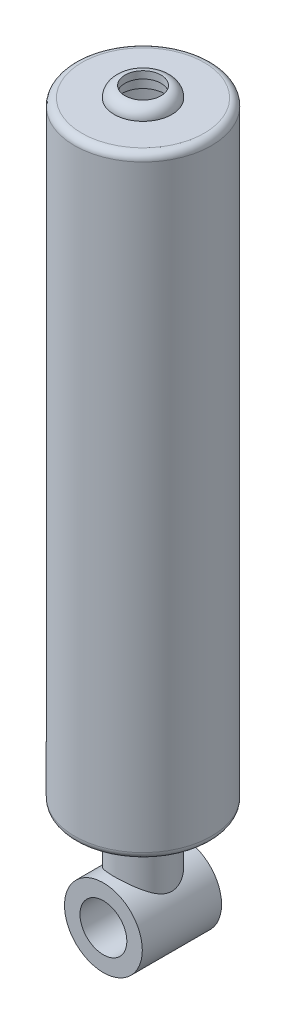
SolidWorks part; units mm, degrees
ref_plane "Plan1" through (0, 0, 0) normal (0, 0, 1) x (1, 0, 0)
ref_plane "Plan2" through (0, 0, 0) normal (0, 1, 0) x (1, 0, 0)
ref_plane "Plan3" through (0, 0, 0) normal (1, 0, 0) x (0, 0, -1)
sketch "Esquisse1" plane through (0, 0, 0) normal (0, 0, 1) x (1, 0, 0)
  circle A0 centre (0, 0) radius 10.8
  dimension "D1" = 21.6
extrude "Base-Extrusion" add sketch "Esquisse1" along normal blind 22
sketch "Esquisse2" plane through (0, 0, 0) normal (0, 1, 0) x (1, 0, 0)
  line L0 (0, -22) -> (0, 0) construction
  line L1 (-10.8, -22) -> (10.8, -22) construction
  circle A0 centre (0, -11) radius 8
  dimension "D1" = 16
  dimension "D2" = 11
extrude "Boss.-Extru.1" add sketch "Esquisse2" along normal blind 30
sketch "Esquisse3" plane through (0, 0, 0) normal (0, 0, -1) x (-1, 0, 0)
  circle A0 centre (0, 0) radius 6.5
  dimension "D1" = 13
extrude "Enlèv. mat.-Extru.1" cut sketch "Esquisse3" against normal through all
sketch "Esquisse4" plane through (0, 0, 0) normal (1, 0, 0) x (0, 0, -1)
  line L0 (-11, 0) -> (-11, 105) construction
  line L1 (-22, 0) -> (0, 0) construction
  line L2 (-11, 21) -> (2, 21)
  line L3 (2, 21) -> (2, 24)
  line L4 (2, 24) -> (8, 24)
  line L5 (8, 24) -> (8, 194)
  line L6 (-11, 21) -> (-11, 23)
  line L7 (-11, 23) -> (-5, 23)
  line L8 (-5, 23) -> (-5, 26)
  line L9 (-5, 26) -> (6, 26)
  line L10 (6, 26) -> (6, 192)
  line L12 (-11, 197) -> (-11, 195)
  line L13 (-5, 195) -> (-5, 192)
  line L14 (-5, 192) -> (6, 192)
  line L15 (-3, 194) -> (8, 194)
  line L16 (-3, 197) -> (-3, 194)
  line L17 (-11, 195) -> (-5, 195)
  line L18 (-11, 197) -> (-3, 197)
  line L21 (0, -10.8) -> (0, 10.8) construction
  dimension "D1" = 170
  dimension "D2" = 19
  dimension "D3" = 11
revolve "Boss.-Révol.1" add sketch "Esquisse4" angle 360 about L0
other "Perçage1" parameters "D1"=30
sketch "Esquisse5" plane through (0, 197, 0) normal (0, 1, 0) x (-1, 0, 0)
  circle A0 centre (0, 11) radius 5
  circle A1 centre (0, 11) radius 8 construction
  dimension "D1" = 10
fillet "Congé1" radius 2
fillet "Congé2" radius 3
fillet "Congé3" radius 3
fillet "Congé4" radius 2
other "Perçage2" parameters "D1"=10
sketch "Esquisse6" plane through (0, 30, 0) normal (0, 1, 0) x (-1, 0, 0)
  circle A0 centre (0, 11) radius 5
  circle A1 centre (0, 11) radius 8 construction
  dimension "D1" = 10
